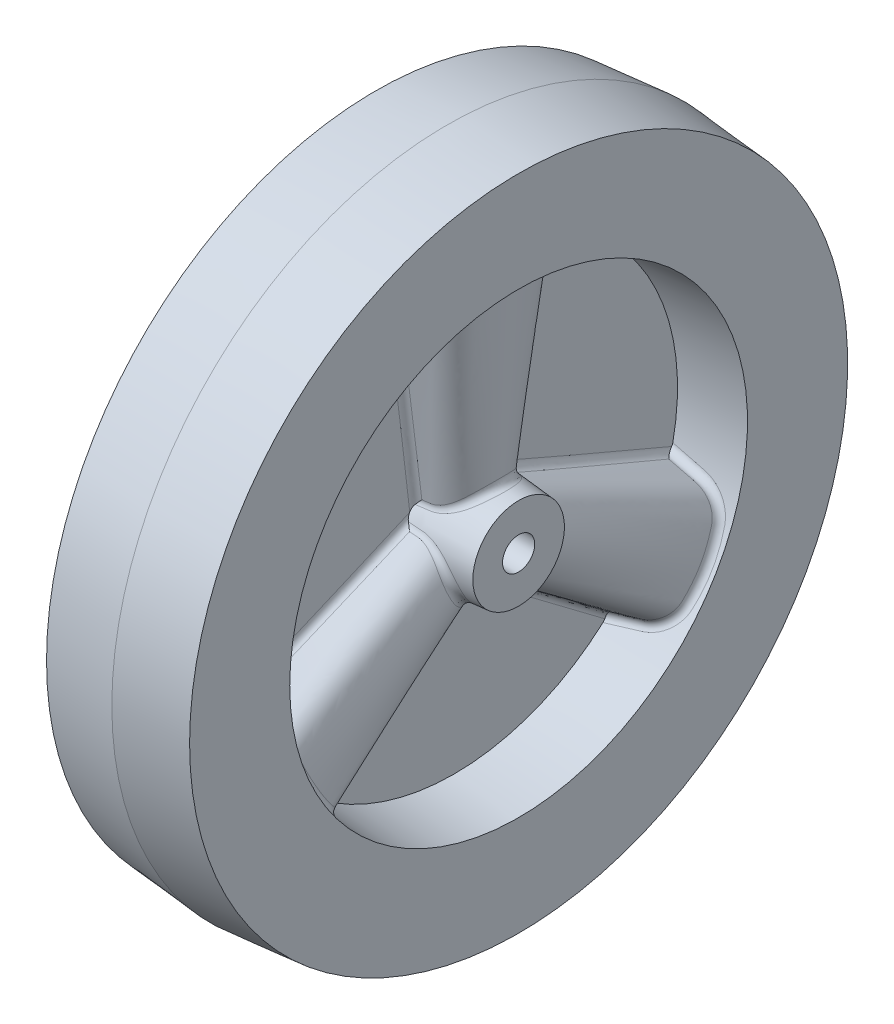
SolidWorks part; units mm, degrees
ref_plane "Front" through (0, 0, 0) normal (0, 0, 1) x (1, 0, 0)
ref_plane "Top" through (0, 0, 0) normal (0, 1, 0) x (1, 0, 0)
ref_plane "Right" through (0, 0, 0) normal (1, 0, 0) x (0, 0, -1)
sketch "Sketch1" plane through (0, 0, 0) normal (0, 0, 1) x (1, 0, 0)
  line L0 (0, 0) -> (0, 74.4139) construction
  line L1 (15.875, 0) -> (-15.875, 0)
  line L2 (1.5875, 11.41) -> (1.5875, 49.55)
  line L3 (1.5875, 49.55) -> (15.875, 50.8)
  line L4 (15.875, 50.8) -> (15.875, 73.025)
  line L5 (15.875, 73.025) -> (0, 74.4139)
  line L6 (0, 0) -> (15.875, 0) construction
  line L7 (-15.875, 73.025) -> (0, 74.4139)
  line L8 (-15.875, 50.8) -> (-15.875, 73.025)
  line L9 (-1.5875, 49.55) -> (-15.875, 50.8)
  line L10 (-1.5875, 11.41) -> (-1.5875, 49.55)
  line L11 (1.5875, 11.41) -> (15.875, 10.16)
  line L12 (-1.5875, 11.41) -> (-15.875, 10.16)
  line L13 (-15.875, 10.16) -> (-15.875, 0)
  line L14 (15.875, 10.16) -> (15.875, 0)
  line L15 (1.5875, 11.41) -> (15.875, 11.41) construction
  line L16 (-15.875, 61.9125) -> (15.875, 61.9125) construction
  dimension "D1" = 3.175
  dimension "D2" = 5
  dimension "D3" = 5
  dimension "D4" = 5
  dimension "D5" = 31.75
  dimension "D6" = 101.6
  dimension "D7" = 146.05
  dimension "D8" = 10.16
revolve "Base-Revolve" add sketch "Sketch1" angle 360 about L6
sketch "Sketch2" plane through (0, 0, 0) normal (0, 1, 0) x (1, 0, 0)
  line L0 (0, 0) -> (52.9894, 0) construction
  line L1 (0, -7.9269) -> (0, 7.9269)
  line L2 (0, 7.9269) -> (3.8391, 7.591)
  line L3 (0, -7.9269) -> (3.8391, -7.591)
  line L4 (0, -74.4139) -> (0, 74.4139) construction
  arc A0 (3.8391, 7.591) -> (3.8391, -7.591) centre (3.175, 0) cw
  point P5 (0, 0)
  dimension "D2" = 7.62
  dimension "D1" = 5
  dimension "D3" = 3.175
ref_plane "Loft Sketch" through (0, 61.9125, 0) normal (0, 1, 0) x (-1, 0, 0)
sketch "Sketch3" plane through (0, 61.9125, 0) normal (0, 1, 0) x (-1, 0, 0)
  line L0 (0, 0) -> (-57.0557, 0) construction
  line L1 (0, 15.875) -> (0, -15.875)
  line L2 (0, 74.4139) -> (0, -74.4139) construction
  line L3 (0, -15.875) -> (-9.581, -13.3078)
  line L4 (0, 15.875) -> (-9.581, 13.3078)
  line L5 (-14.2875, 7.1741) -> (-14.2875, -7.1741)
  line L6 (-15.875, 73.025) -> (-15.875, -73.025) construction
  arc A0 (-14.2875, -7.1741) -> (-9.581, -13.3078) centre (-7.9375, -7.1741) ccw
  arc A1 (-14.2875, 7.1741) -> (-9.581, 13.3078) centre (-7.9375, 7.1741) cw
  point P7 (0, 0)
  dimension "D1" = 6.35
  dimension "D2" = 6.35
  dimension "D3" = 31.75
  dimension "D4" = 15
  dimension "D5" = 1.5875
loft "Boss-Loft1" add profiles "Sketch3", "Sketch2"
pattern_circular "CirPattern2" count 3 over 360 about axis through (0, 0, 0) along (1, 0, 0)
combine bodies "Combine1" operation type add bodies to combine 101 102 106 107
fillet "Fillet1" radius 1.5875 12 edges at (11.3785, 10.5472, -0.361) (11.3785, -4.961, 9.3147) (11.3785, -5.5862, -8.9537) (1.5875, 30.3852, 11.4864) (1.5875, -8.7177, 40.2874) (1.5875, 39.5326, -12.6295) (1.5875, -5.1894, -31.9258) (1.5875, -26.0312, 21.7493) (1.5875, -24.9524, -20.323) (13.6392, 50.598, -0.8033) (13.6392, -25.9947, -43.4175) (13.6392, -24.6033, 44.2208)
sketch "Sketch4" plane through (15.875, 0, 0) normal (1, 0, 0) x (0, 0, -1)
  circle A0 centre (0, 0) radius 3.5719
  dimension "D1" = 7.1437
extrude "Cut-Extrude1" cut sketch "Sketch4" against normal through all
sketch "Sketch5" plane through (15.875, 0, 0) normal (1, 0, 0) x (0, 0, -1)
  line L0 (0, 0) -> (0, -74.4139) construction
  circle A0 centre (0, 0) radius 74.4139 construction
ref_plane "BOTTOM" through (0, -74.4139, 0) normal (0, 1, 0) x (-1, 0, 0)
